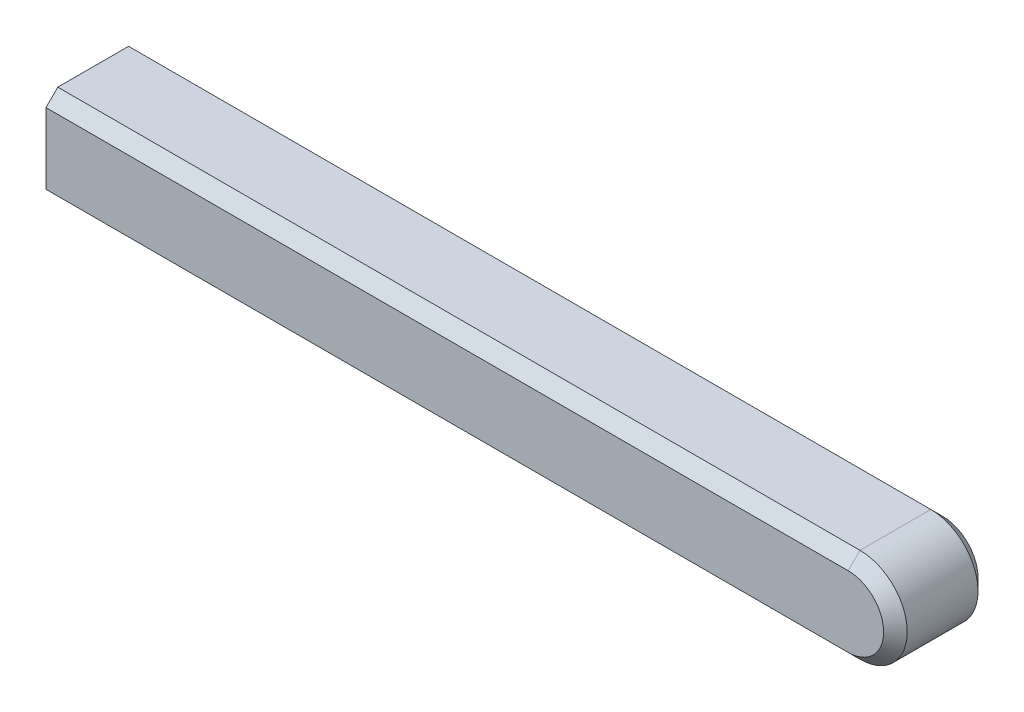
SolidWorks part; units mm, degrees
ref_plane "Front" through (0, 0, 0) normal (0, 0, 1) x (1, 0, 0)
ref_plane "Top" through (0, 0, 0) normal (0, 1, 0) x (1, 0, 0)
ref_plane "Right" through (0, 0, 0) normal (1, 0, 0) x (0, 0, -1)
other "Configuration Table"
sketch "body" plane through (0, 0, 0) normal (0, 0, 1) x (1, 0, 0)
  line L1 (0, 0) -> (17, 0)
  line L2 (0, 0) -> (0, 2)
  line L3 (0, 2) -> (17, 2)
  arc A0 (17, 0) -> (17, 2) centre (17, 1) ccw
  dimension "Width" = 2
  dimension "Length" = 18
extrude "Extrude1" add sketch "body" along normal blind 2
chamfer "Chamfer1" distance 0.25 6 edges at (8.5, 2, 0) (18, 1, 0) (8.5, 0, 0) (8.5, 2, 2) (18, 1, 2) (8.5, 0, 2)
